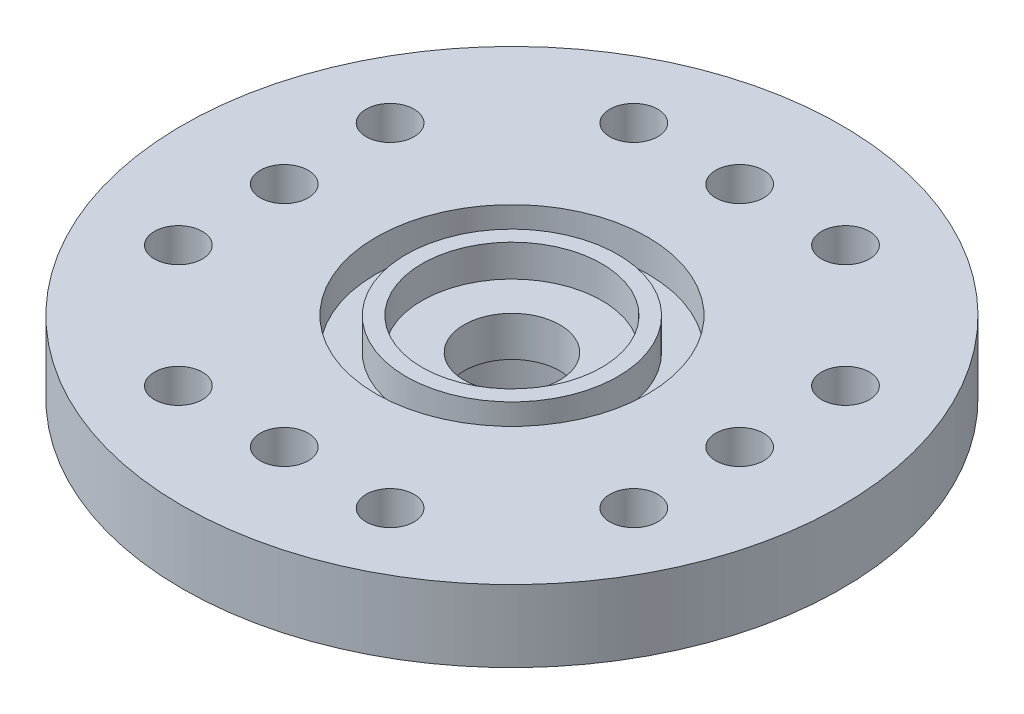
SolidWorks part; units mm, degrees
ref_plane "Front Plane" through (0, 0, 0) normal (0, 0, 1) x (1, 0, 0)
ref_plane "Top Plane" through (0, 0, 0) normal (0, 1, 0) x (1, 0, 0)
ref_plane "Right Plane" through (0, 0, 0) normal (1, 0, 0) x (0, 0, -1)
sketch "Sketch1" plane through (0, 0, 0) normal (0, 1, 0) x (1, 0, 0)
  line L0 (-3.3655, 7.239) -> (3.3655, 7.239) construction
  line L1 (0, 0) -> (0, 7.239) construction
  circle A0 centre (0, 0) radius 10.4775
  circle A1 centre (0, 7.239) radius 0.762
  circle A2 centre (3.3655, 7.239) radius 0.762
  circle A3 centre (-3.3655, 7.239) radius 0.762
  circle A4 centre (0, 0) radius 1.524
  circle A5 centre (7.239, -3.3655) radius 0.762
  circle A6 centre (7.239, 0) radius 0.762
  circle A7 centre (7.239, 3.3655) radius 0.762
  circle A8 centre (-3.3655, -7.239) radius 0.762
  circle A9 centre (0, -7.239) radius 0.762
  circle A10 centre (3.3655, -7.239) radius 0.762
  circle A11 centre (-7.239, 3.3655) radius 0.762
  circle A12 centre (-7.239, 0) radius 0.762
  circle A13 centre (-7.239, -3.3655) radius 0.762
  point P5 (0, 7.239)
  point P10 (-4.1275, 7.239)
  point P11 (4.1275, 7.239)
  point P13 (0, -1.524)
  point P14 (0, 8.001)
  point P36 (0, 0)
  dimension "D1" = 1.524
  dimension "D2" = 20.955
  dimension "D4" = 3.048
  dimension "D3" = 8.255
  dimension "D5" = 9.525
  dimension "D6" = 4
extrude "Boss-Extrude1" add sketch "Sketch1" along normal blind 2.286
sketch "Sketch2" plane through (0, 2.286, 0) normal (0, 1, 0) x (1, 0, 0)
  circle A0 centre (0, 0) radius 4.318
  circle A1 centre (0, 0) radius 2.8575
  circle A2 centre (0, 0) radius 3.3655
  circle A3 centre (0, 0) radius 1.524 construction
  circle A4 centre (0, 0) radius 1.524
  dimension "D1" = 8.636
  dimension "D2" = 6.731
  dimension "D3" = 5.715
extrude "Cut-Extrude1" cut sketch "Sketch2" against normal blind 1.016 contours A1 M5 | A0 A2
sketch "Sketch3" plane through (0, 0, 0) normal (0, -1, 0) x (1, 0, 0)
  circle A0 centre (0, 0) radius 4.3815
  circle A1 centre (0, 0) radius 3.175
  dimension "D1" = 8.763
  dimension "D2" = 6.35
extrude "Boss-Extrude2" add sketch "Sketch3" along normal blind 3.048
